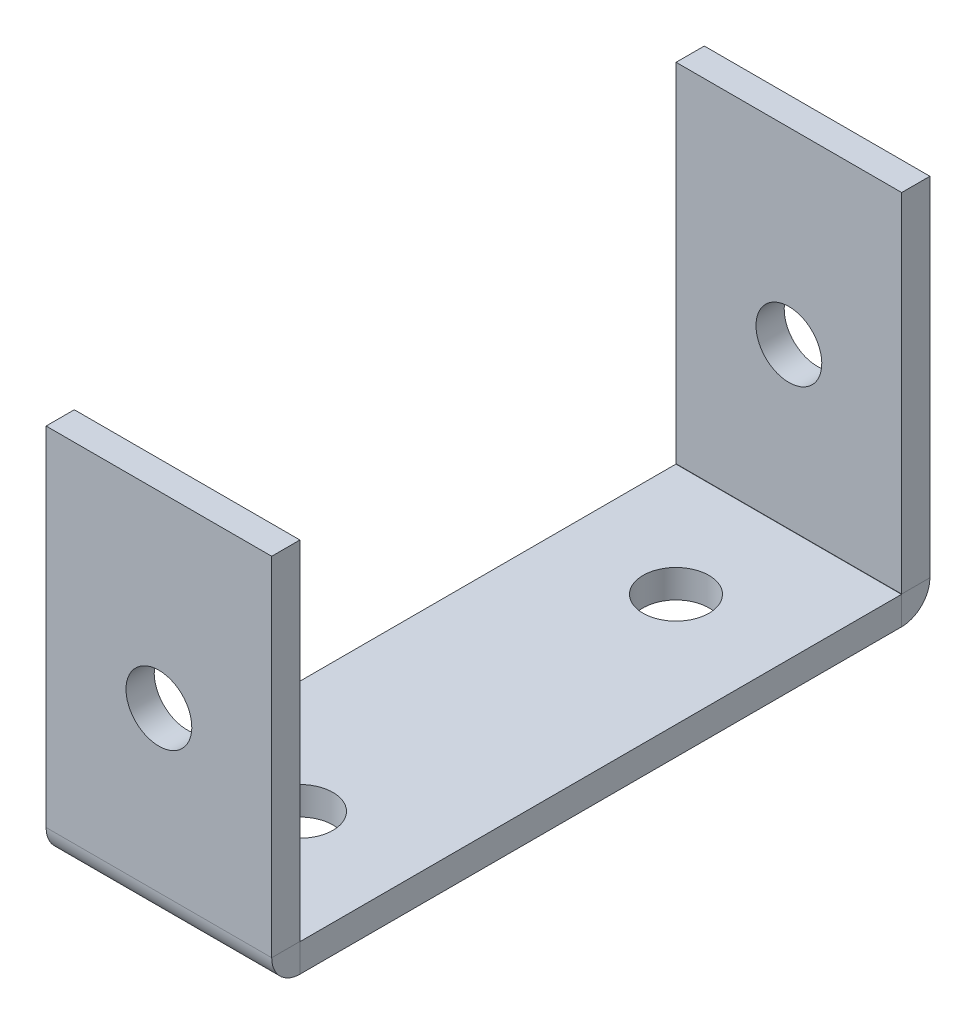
SolidWorks part; units mm, degrees
ref_plane "Front" through (0, 0, 0) normal (0, 0, 1) x (1, 0, 0)
ref_plane "Top" through (0, 0, 0) normal (0, 1, 0) x (1, 0, 0)
ref_plane "Right" through (0, 0, 0) normal (1, 0, 0) x (0, 0, -1)
sketch "Sketch1" plane through (0, 0, 0) normal (0, 1, 0) x (1, 0, 0)
  line L1 (0, 0) -> (12, 0)
  line L2 (0, 0) -> (0, 75)
  line L3 (0, 75) -> (12, 75)
  line L4 (12, 0) -> (12, 75)
  circle A0 centre (6, 65) radius 1.75
  circle A1 centre (6, 47.5) radius 1.75
  circle A2 centre (6, 27.5) radius 1.75
  circle A3 centre (6, 10) radius 1.75
sheet metal parameters "Sheet-Metal1" thickness 1.5 parameters "D1"=0.01
base flange "Base-Flange1" sketch "Sketch1" thickness 1.5 reverse thickness direction yes parameters "D1"=0.01
sketch "Sketch4" plane through (0, 1.5, 0) normal (0, 1, 0) x (-1, 0, 0)
  line L2 (0, -55) -> (-12, -55)
  line L3 (0, -20) -> (-12, -20)
sketched bend "Sketched Bend1" parameters "D1"=0
bend "SketchBend1" bend radius 0.01 bend angle 90 parameters "D5"=1
bend "SketchBend2" bend radius 0 bend angle 90 parameters "D5"=2
flat pattern "Flat-Pattern1"
sketch "Bend-Lines1" plane through (0, 1.5, 0) normal (0, 1, 0) x (-1, 0, 0)
  line L0 (0, -20) -> (-12, -20) construction
  line L1 (0, -55) -> (-12, -55) construction
bend of the flat pattern "Flatten-<SketchBend1>1"
bend of the flat pattern "Flatten-<SketchBend2>1"
